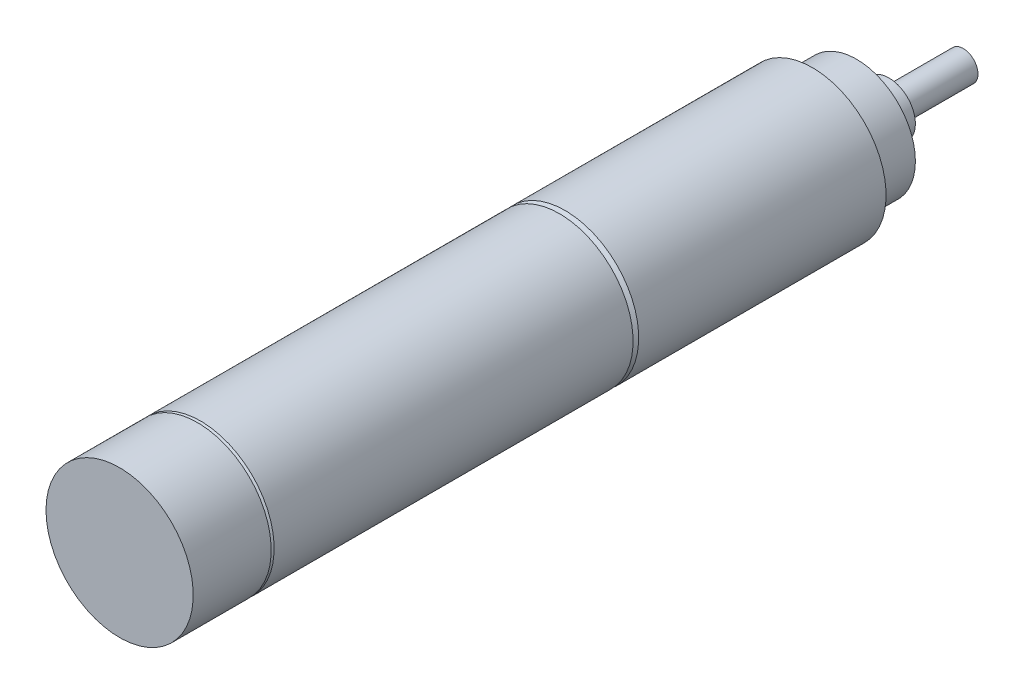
SolidWorks part; units mm, degrees
ref_plane "Front" through (0, 0, 0) normal (0, 0, 1) x (1, 0, 0)
ref_plane "Top" through (0, 0, 0) normal (0, 1, 0) x (1, 0, 0)
ref_plane "Right" through (0, 0, 0) normal (1, 0, 0) x (0, 0, -1)
sketch "Sketch1" plane through (0, 0, 0) normal (0, 0, 1) x (1, 0, 0)
  circle A0 centre (0, 0) radius 5.0038
  dimension "D1" = 10.0076
extrude "Extrude1" add sketch "Sketch1" along normal blind 17.1958
chamfer "Chamfer1" distance 0.381 angle 45 1 edges at (5.0038, 0, 17.1958)
sketch "Sketch2" plane through (0, 0, 17.1958) normal (0, 0, 1) x (1, 0, 0)
  circle A0 centre (0, 0) radius 5.0038
  circle A1 centre (0, 0) radius 5.0038 construction
extrude "Extrude2" add sketch "Sketch2" along normal blind 24.6
sketch "Sketch3" plane through (0, 0, 0) normal (0, 0, -1) x (-1, 0, 0)
  circle A0 centre (0, 0) radius 4.0005
  circle A1 centre (0, 0) radius 5.0038 construction
  dimension "D1" = 8.001
extrude "Extrude3" add sketch "Sketch3" along normal blind 2.9972
sketch "Sketch5" plane through (0, 0, 0) normal (0, 0, -1) x (-1, 0, 0)
  circle A0 centre (0, 0) radius 1.0033
  circle A1 centre (0, 0) radius 5.0038 construction
  dimension "D1" = 2.0066
extrude "Extrude4" add sketch "Sketch5" along normal blind 10.25
chamfer "Chamfer2" distance 0.2 angle 45 1 edges at (5.0038, 0, 41.7958)
sketch "Sketch6" plane through (0, 0, 41.7958) normal (0, 0, 1) x (1, 0, 0)
  circle A0 centre (0, 0) radius 5.0038
  circle A1 centre (0, 0) radius 5.0038 construction
extrude "Extrude5" add sketch "Sketch6" along normal blind 5.3
sketch "Sketch7" plane through (0, 0, -2.9972) normal (0, 0, -1) x (-1, 0, 0)
  circle A0 centre (0, 0) radius 2.5
  dimension "D1" = 5
extrude "Extrude6" add sketch "Sketch7" along normal blind 1
sketch "Sketch8" plane through (0, 0, -3.9972) normal (0, 0, -1) x (-1, 0, 0)
  circle A0 centre (0, 0) radius 1.8
  dimension "D1" = 3.6
extrude "Extrude7" add sketch "Sketch8" along normal blind 1.2
